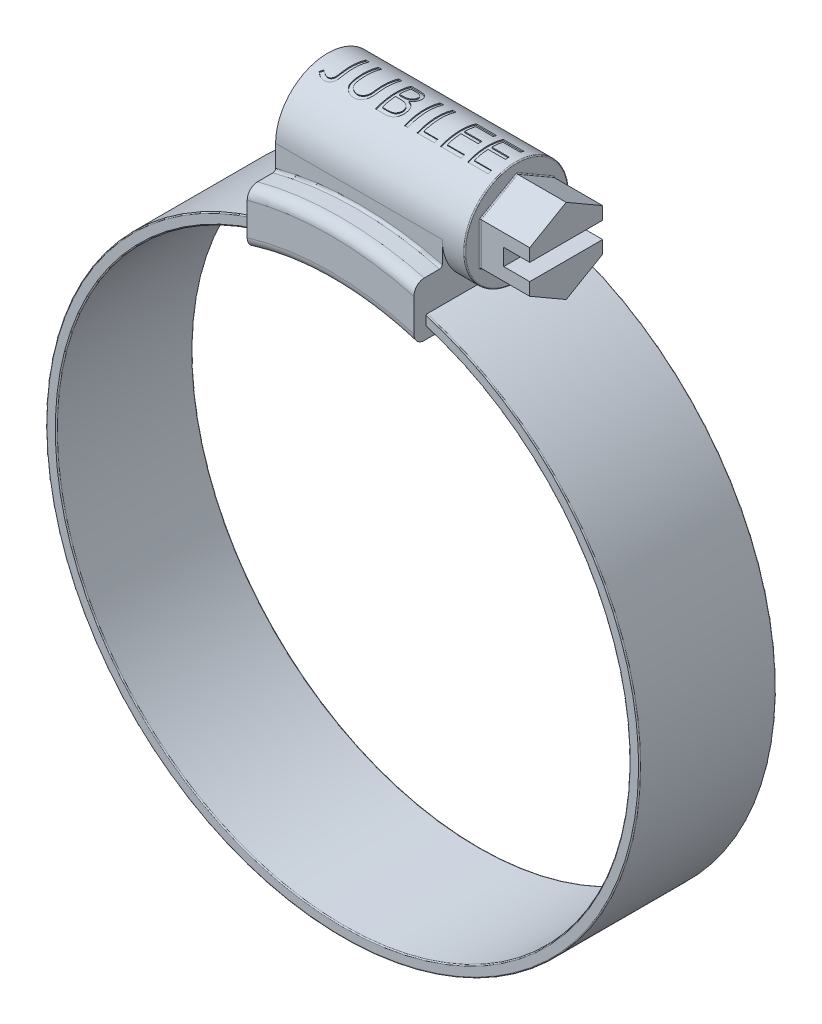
SolidWorks part; units mm, degrees
ref_plane "Front Plane" through (0, 0, 0) normal (0, 0, 1) x (1, 0, 0)
ref_plane "Top Plane" through (0, 0, 0) normal (0, 1, 0) x (1, 0, 0)
ref_plane "Right Plane" through (0, 0, 0) normal (1, 0, 0) x (0, 0, -1)
sketch "Sketch1" plane through (0, 0, 0) normal (0, 0, 1) x (1, 0, 0)
  line L0 (0, 0) -> (0, 27.5) construction
  circle A0 centre (0, 0) radius 27.5
  dimension "D1" = 55
extrude "Extrude-Thin1" add sketch "Sketch1" along normal mid plane 13.1 thin
sketch "Sketch2" plane through (0, 0, 0) normal (0, 0, 1) x (1, 0, 0)
  line L0 (-8, 0) -> (8, 0) construction
  line L1 (-8, 0) -> (-8, 30.4672) construction
  line L2 (0, 0) -> (0, 35.1201) construction
  line L3 (8, 0) -> (8, 30.4672) construction
  line L4 (-8, 30.4672) -> (-8, 25.2636)
  line L5 (8, 25.2636) -> (8, 30.4672)
  arc A0 (8, 25.2636) -> (-8, 25.2636) centre (0, 0) ccw
  arc A1 (8, 30.4672) -> (-8, 30.4672) centre (0, 0) ccw
  circle A2 centre (0, 0) radius 27.5 construction
  point P1 (0, 26.5)
  point P6 (0, 0)
  dimension "D1" = 1
  dimension "D2" = 5
  dimension "D3" = 16
extrude "Boss-Extrude1" add sketch "Sketch2" along normal mid plane 15.45
sketch "Sketch4" plane through (0, 0, 0) normal (1, 0, 0) x (0, 0, -1)
  line L0 (0, 26.5) -> (0, 37.8) construction
  line L1 (0, 37.8) -> (0, 32.8) construction
  line L2 (-5, 32.8) -> (-5, 30.4672)
  line L3 (-7.725, 30.4672) -> (7.725, 30.4672) construction
  line L4 (-5, 30.4672) -> (5, 30.4672)
  line L5 (5, 30.4672) -> (5, 32.8)
  arc A1 (5, 32.8) -> (-5, 32.8) centre (0, 32.8) ccw
  dimension "D3" = 10
  dimension "D1" = 11.3
  dimension "D2" = 5
extrude "Boss-Extrude2" add sketch "Sketch4" along normal up to surface and the other way up to surface contours A1 L2 L4 L5
sketch "Sketch6" plane through (0, 0, 0) normal (1, 0, 0) x (0, 0, -1)
  circle A0 centre (0, 32.8) radius 5
  dimension "D1" = 10
sketch "Sketch7" plane through (8, 0, 0) normal (1, 0, 0) x (0, 0, -1)
  circle A0 centre (0, 32.8) radius 5
extrude "Boss-Extrude4" add sketch "Sketch7" along normal blind 2.15
sketch "Sketch8" plane through (10.15, 0, 0) normal (1, 0, 0) x (0, 0, -1)
  line L1 (0.0005, 28.7585) -> (3.5002, 30.7797)
  line L2 (3.5002, 30.7797) -> (3.4998, 34.8211)
  line L3 (3.4998, 34.8211) -> (-0.0005, 36.8415)
  line L4 (-0.0005, 36.8415) -> (-3.5002, 34.8203)
  line L5 (-3.5002, 34.8203) -> (-3.4998, 30.7789)
  line L6 (-3.4998, 30.7789) -> (0.0005, 28.7585)
  circle A0 centre (0, 32.8) radius 3.5 construction
  dimension "D1" = 7
extrude "Boss-Extrude5" add sketch "Sketch8" along normal blind 4.75
sketch "Sketch9" plane through (14.9, 0, 0) normal (1, 0, 0) x (0, 0, -1)
  line L0 (0, 0) -> (0, 32.8) construction
  line L2 (-3.9589, 31.9996) -> (3.959, 32.0004)
  line L3 (-3.9589, 31.9996) -> (-3.959, 33.5996)
  line L4 (3.959, 32.0004) -> (3.9589, 33.6004)
  line L5 (-3.959, 33.5996) -> (3.9589, 33.6004)
  line L6 (-3.9589, 31.9996) -> (3.9589, 33.6004) construction
  line L7 (3.959, 32.0004) -> (-3.959, 33.5996) construction
  line L8 (-3.5002, 34.8203) -> (-3.4998, 30.7789) construction
  dimension "D1" = 1.6
  dimension "D2" = 7.9179
extrude "Cut-Extrude1" cut sketch "Sketch9" against normal blind 2.5
ref_plane "Plane1" through (0, 37.8, 0) normal (0, 1, 0) x (1, 0, 0)
sketch "Sketch11" plane through (0, 37.8, 0) normal (0, 1, 0) x (1, 0, 0)
  line L0 (0, 0) -> (0, -2) construction
  line L1 (-8, -2) -> (10.15, -2) construction
  line L2 (-8, 6.55) -> (-8, -6.55) construction
  line L3 (10.15, -5) -> (10.15, 5) construction
  text T0 "JUBILEE"
  dimension "D1" = 2
wrap "Wrap2" sketch "Sketch11" wrap type deboss source sketch "Sketch11" thickness 0.1 parameters "D1"=0.1
fillet "Fillet1" radius 0.1 11 edges at (10.15, 32.8004, -3.5) (10.15, 29.7691, -1.7503) (10.15, 29.7687, 1.7497) (10.15, 32.7996, 3.5) (10.15, 35.8313, -1.7497) (10.15, 35.8309, 1.7503) (0, -27.5, -6.55) (0, -27.5, 6.55) (0, -28.5, -6.55) (0, -28.5, 6.55) (10.15, 32.8, -5)
fillet "Fillet2" radius 1 4 edges at (0, 26.5, 7.725) (0, 26.5, -7.725) (0, 31.5, -7.725) (0, 31.5, 7.725)
fillet "Fillet3" radius 0.25 2 edges at (0, 31.5, -5) (0, 31.5, 5)
